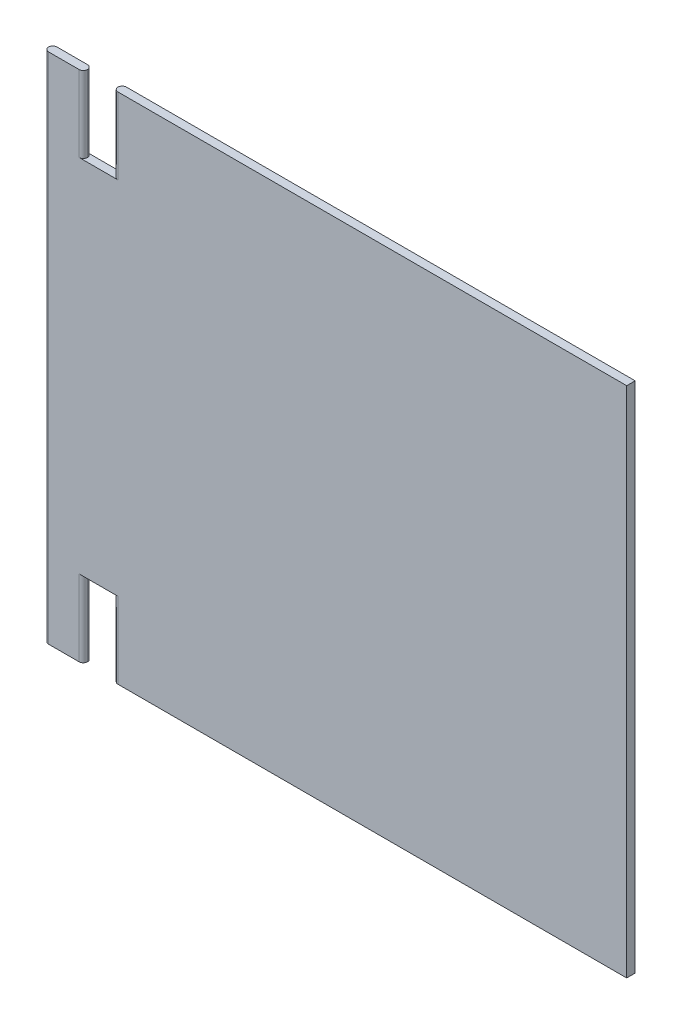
SolidWorks part; units mm, degrees
ref_plane "Front Plane" through (0, 0, 0) normal (0, 0, 1) x (1, 0, 0)
ref_plane "Top Plane" through (0, 0, 0) normal (0, 1, 0) x (1, 0, 0)
ref_plane "Right Plane" through (0, 0, 0) normal (1, 0, 0) x (0, 0, -1)
sketch "Sketch2" plane through (0, 0, 0) normal (0, 0, 1) x (1, 0, 0)
  line L1 (38.481, -38.481) -> (-38.481, -38.481)
  line L2 (38.481, -38.481) -> (38.481, 38.481)
  line L3 (38.481, 38.481) -> (-38.481, 38.481)
  line L4 (-38.481, -38.481) -> (-38.481, 38.481)
  line L5 (38.481, -38.481) -> (-38.481, 38.481) construction
  line L6 (38.481, 38.481) -> (-38.481, -38.481) construction
  point P0 (0, 0)
  dimension "D1" = 76.962
  dimension "D2" = 76.962
extrude "Boss-Extrude1" add sketch "Sketch2" along normal blind 1.27
sketch "Sketch3" plane through (-38.481, 0, 0) normal (-1, 0, 0) x (0, 0, 1)
  line L0 (1.27, 38.481) -> (1.27, -38.481) construction
  line L1 (1.27, 27.051) -> (0, 27.051)
  line L2 (1.27, 27.051) -> (1.27, -27.051)
  line L3 (1.27, -27.051) -> (0, -27.051)
  line L4 (0, 27.051) -> (0, -27.051)
  line L5 (0, 38.481) -> (0, -38.481) construction
  line L6 (0.635, 38.481) -> (0.635, 27.051) construction
  line L7 (1.27, 38.481) -> (0, 38.481) construction
  line L8 (0.635, -27.051) -> (0.635, -38.481) construction
  line L9 (1.27, -38.481) -> (0, -38.481) construction
  dimension "D1" = 11.43
  dimension "D2" = 11.43
extrude "Boss-Extrude2" add sketch "Sketch3" along normal blind 4.572
sketch "Sketch4" plane through (-43.053, 0, 0) normal (-1, 0, 0) x (0, 0, 1)
  line L1 (0, 38.481) -> (1.27, 38.481)
  line L2 (0, 38.481) -> (0, -38.481)
  line L3 (0, -38.481) -> (1.27, -38.481)
  line L4 (1.27, 38.481) -> (1.27, -38.481)
extrude "Boss-Extrude3" add sketch "Sketch4" along normal blind 5.842
fillet "Fillet1" radius 0.635 6 edges at (-43.053, 32.766, 1.27) (-43.053, 32.766, 0) (-43.053, -32.766, 0) (-43.053, -32.766, 1.27) (-48.895, 0, 0) (-48.895, 0, 1.27)
fillet "Fillet2" radius 0.635 4 edges at (-38.481, -32.766, 1.27) (-38.481, -32.766, 0) (-38.481, 32.766, 1.27) (-38.481, 32.766, 0)
